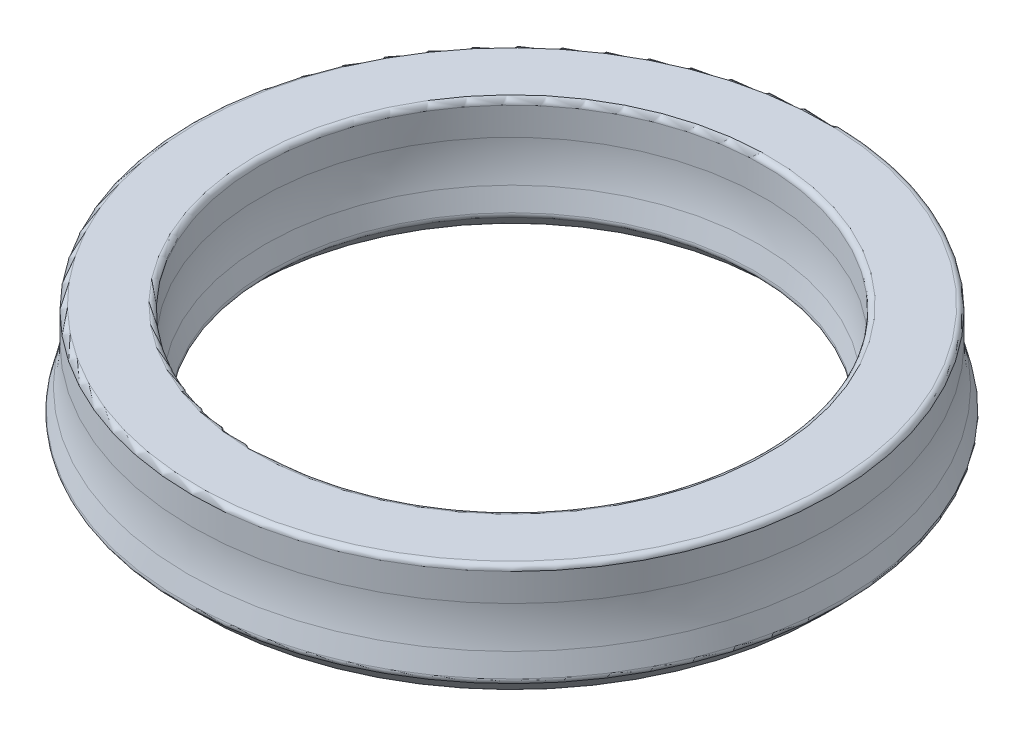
SolidWorks part; units mm, degrees
ref_plane "Front" through (0, 0, 0) normal (0, 0, 1) x (1, 0, 0)
ref_plane "Top" through (0, 0, 0) normal (0, 1, 0) x (1, 0, 0)
ref_plane "Right" through (0, 0, 0) normal (1, 0, 0) x (0, 0, -1)
sketch "Sketch1" plane through (0, 0, 0) normal (0, 0, 1) x (1, 0, 0)
  line L0 (0, 0) -> (0, 2.794) construction
  line L1 (6.35, 0) -> (5.842, 0.508)
  line L2 (5.842, 0.508) -> (6.096, 1.524)
  line L3 (6.096, 1.524) -> (6.096, 2.794)
  line L4 (6.096, 2.794) -> (7.747, 2.794)
  line L5 (6.35, 0) -> (6.604, 0)
  line L6 (6.604, 0) -> (6.604, 2.286)
  line L7 (6.604, 2.286) -> (7.239, 2.286)
  line L9 (7.239, 0) -> (7.239, 2.286)
  line L10 (7.493, 0) -> (7.239, 0)
  line L11 (7.747, 1.524) -> (7.747, 2.794)
  line L12 (8.001, 0.508) -> (7.747, 1.524)
  line L13 (7.493, 0) -> (8.001, 0.508)
  dimension "D1" = 0.508
  dimension "D2" = 1.016
  dimension "D3" = 2.794
  dimension "D4" = 0.508
  dimension "D5" = 0.508
  dimension "D6" = 0.254
  dimension "D7" = 0.254
  dimension "D8" = 2.159
  dimension "D9" = 0.254
  dimension "D10" = 0.762
  dimension "D11" = 0.254
  dimension "D12" = 0.635
  dimension "D13" = 8.001
revolve "Revolve1" add sketch "Sketch1" angle 360 about L0
fillet "Fillet1" radius 3.81 2 edges at (6.096, 1.524, 0) (7.747, 1.524, 0)
fillet "Fillet2" radius 0.127 10 edges at (7.493, 0, 0) (7.239, 0, 0) (7.239, 2.286, 0) (6.604, 2.286, 0) (6.604, 0, 0) (6.35, 0, 0) (5.842, 0.508, 0) (6.096, 2.794, 0) (7.747, 2.794, 0) (8.001, 0.508, 0)
